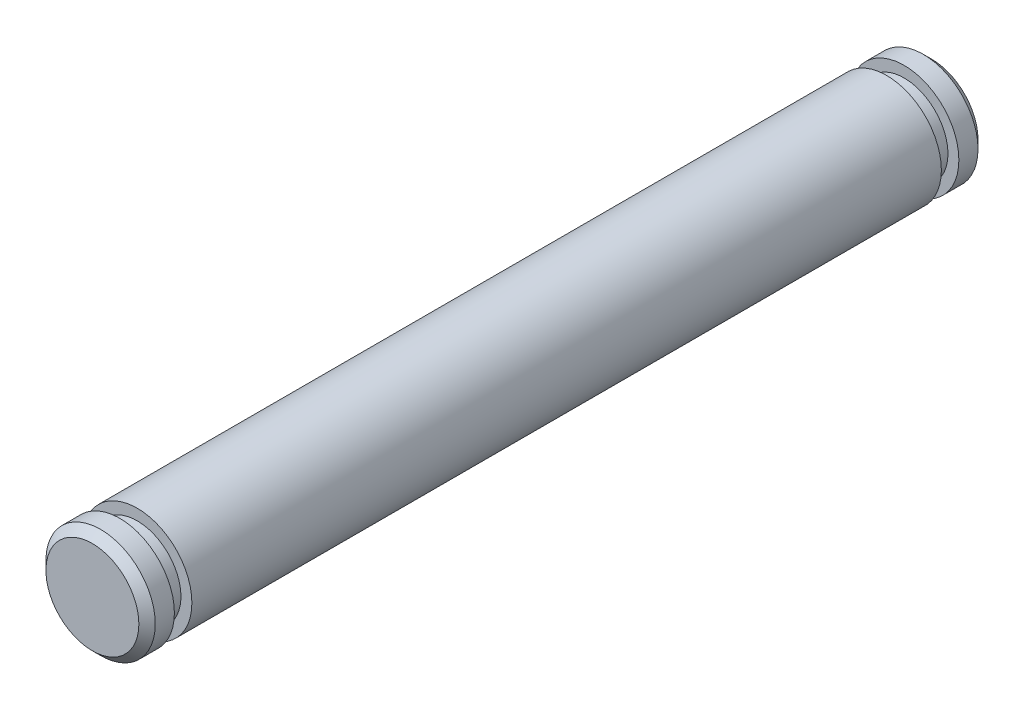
SolidWorks part; units mm, degrees
ref_plane "Plan de face" through (0, 0, 0) normal (0, 0, 1) x (1, 0, 0)
ref_plane "Plan de dessus" through (0, 0, 0) normal (0, 1, 0) x (1, 0, 0)
ref_plane "Plan de droite" through (0, 0, 0) normal (1, 0, 0) x (0, 0, -1)
sketch "Esquisse1" plane through (0, 0, 0) normal (0, 0, 1) x (1, 0, 0)
  circle A0 centre (0, 0) radius 2
  dimension "D1" = 4
extrude "Boss.-Extru.1" add sketch "Esquisse1" along normal blind 30.7
chamfer "Chanfrein1" distance 0.3 angle 45 2 edges at (2, 0, 0) (2, 0, 30.7)
sketch "Esquisse2" plane through (0, 0, 30.7) normal (0, 0, 1) x (1, 0, 0)
  circle A0 centre (0, 0) radius 1.6
  circle A1 centre (0, 0) radius 4.7447
  dimension "D1" = 3.2
extrude "Enlèv. mat.-Extru.1" cut sketch "Esquisse2" along normal blind 0.64 from offset 1.64
pattern_linear "Répétition linéaire1" count 2 spacing 28.06 along (0, 0, -1) of "Enlèv. mat.-Extru.1"
